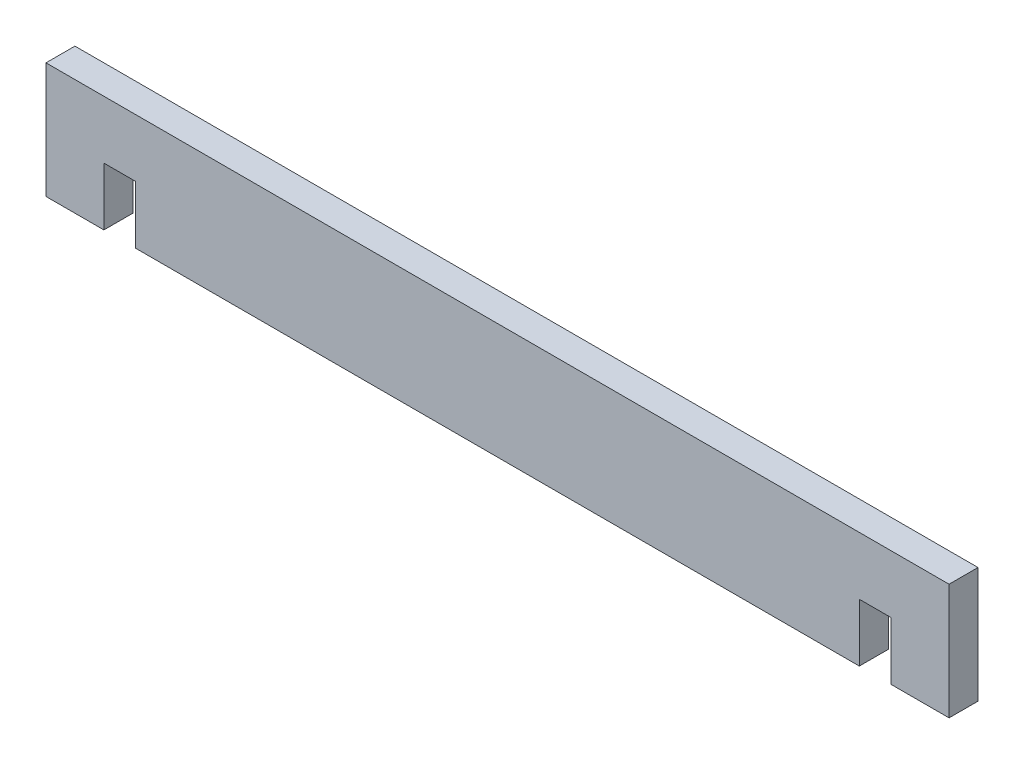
SolidWorks part; units mm, degrees
ref_plane "Plan de face" through (0, 0, 0) normal (0, 0, 1) x (1, 0, 0)
ref_plane "Plan de dessus" through (0, 0, 0) normal (0, 1, 0) x (1, 0, 0)
ref_plane "Plan de droite" through (0, 0, 0) normal (1, 0, 0) x (0, 0, -1)
sketch "Esquisse1" plane through (0, 0, 0) normal (0, 0, 1) x (1, 0, 0)
  line L1 (0, 0) -> (624, 0)
  line L2 (0, 0) -> (0, 80)
  line L3 (0, 80) -> (624, 80)
  line L4 (624, 0) -> (624, 80)
  dimension "D1" = 80
  dimension "D2" = 624
extrude "Boss.-Extru.1" add sketch "Esquisse1" along normal mid plane 20
sketch "Esquisse3" plane through (0, 0, 0) normal (0, 0, 1) x (1, 0, 0)
  line L0 (0, 0) -> (624, 0) construction
  line L1 (40, 0) -> (62, 0)
  line L2 (40, 0) -> (40, 40)
  line L3 (40, 40) -> (62, 40)
  line L4 (62, 0) -> (62, 40)
  line L5 (0, 80) -> (0, 0) construction
  line L6 (562, 40) -> (584, 40)
  line L7 (584, 0) -> (584, 40)
  line L8 (562, 0) -> (562, 40)
  line L9 (562, 0) -> (584, 0)
  dimension "D1" = 22
  dimension "D2" = 40
  dimension "D3" = 40
  dimension "D5" = 500
  dimension "D4" = 2
extrude "Enlèv. mat.-Extru.1" cut sketch "Esquisse3" against normal up to next and the other way up to next
